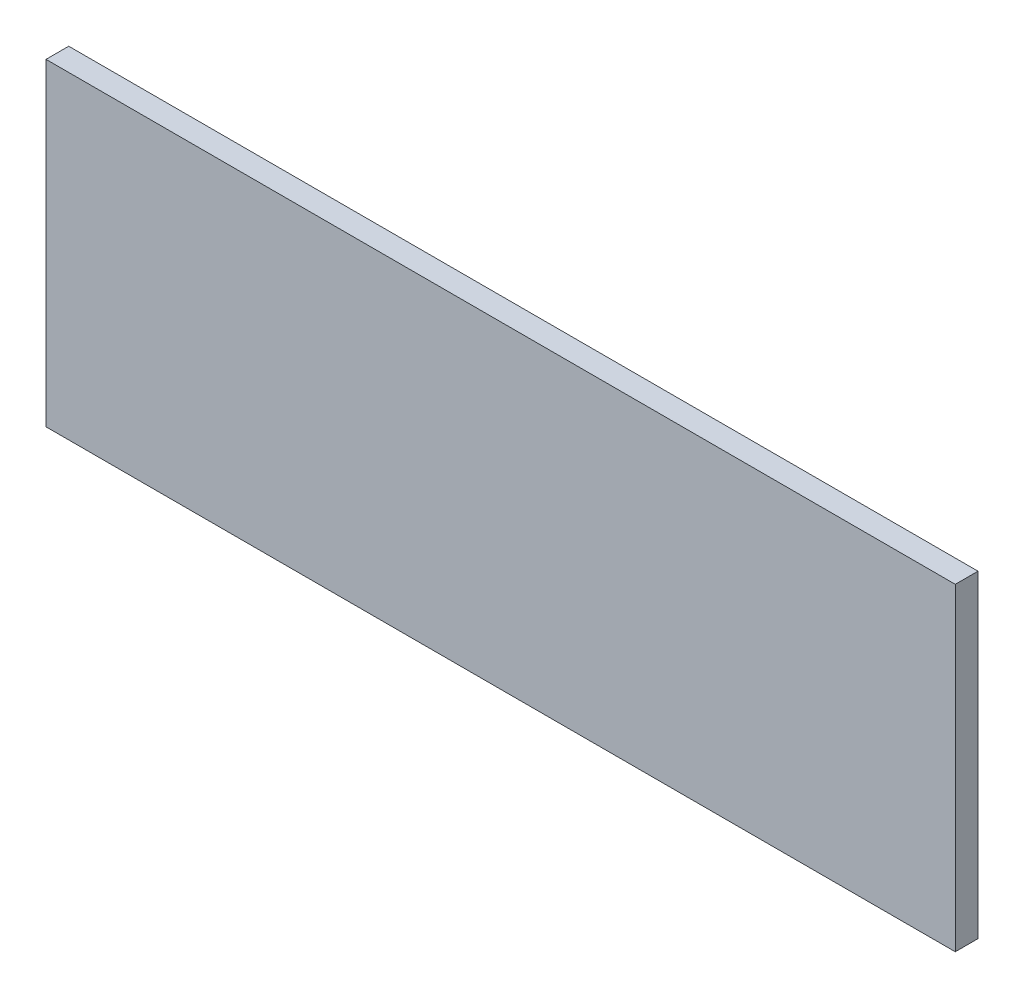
SolidWorks part; units mm, degrees
ref_plane "Front Plane" through (0, 0, 0) normal (0, 0, 1) x (1, 0, 0)
ref_plane "Top Plane" through (0, 0, 0) normal (0, 1, 0) x (1, 0, 0)
ref_plane "Right Plane" through (0, 0, 0) normal (1, 0, 0) x (0, 0, -1)
sketch "Sketch1" plane through (0, 0, 0) normal (0, 0, 1) x (1, 0, 0)
  line L1 (0, 0) -> (254, 0)
  line L2 (0, 0) -> (0, 88.9)
  line L3 (0, 88.9) -> (254, 88.9)
  line L4 (254, 0) -> (254, 88.9)
  dimension "D1" = 254
  dimension "D2" = 88.9
extrude "Boss-Extrude1" add sketch "Sketch1" along normal blind 6.35 contours L3 L4 L1 L2
